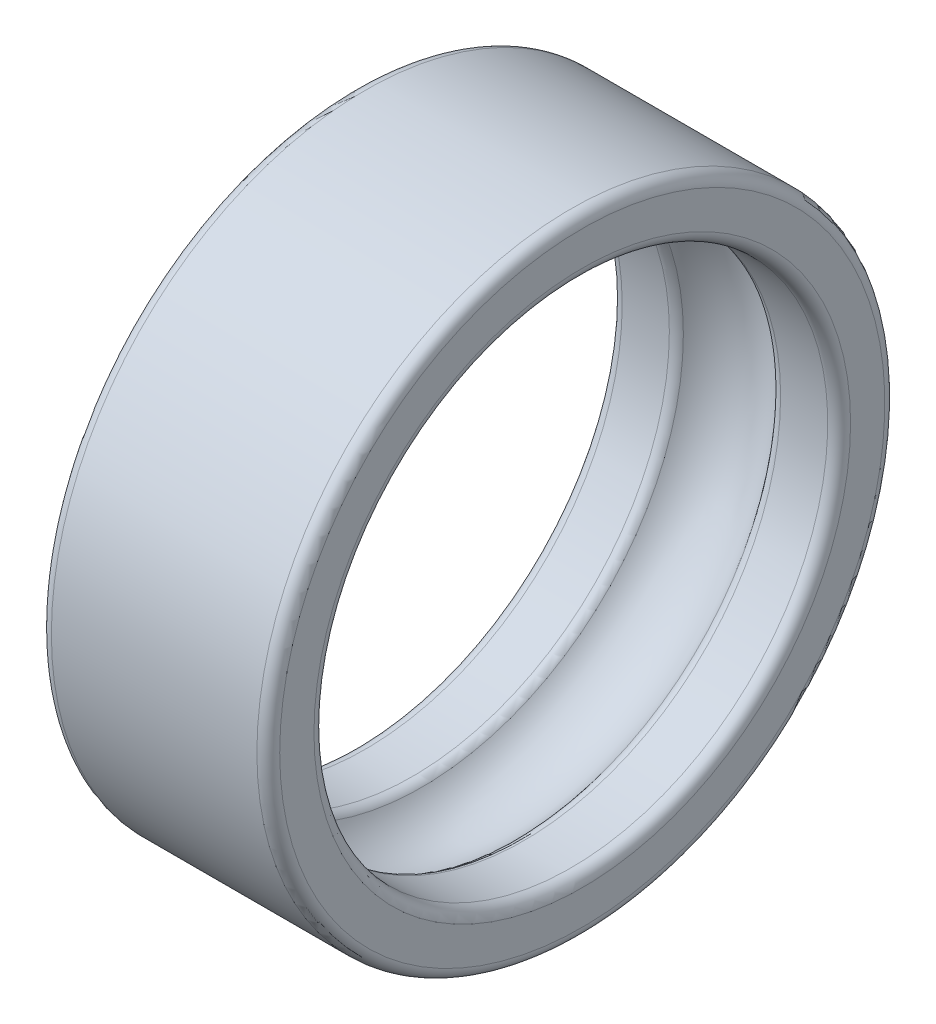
SolidWorks part; units mm, degrees
ref_plane "Plan1" through (0, 0, 0) normal (0, 0, 1) x (1, 0, 0)
ref_plane "Plan2" through (0, 0, 0) normal (0, 1, 0) x (1, 0, 0)
ref_plane "Plan3" through (0, 0, 0) normal (1, 0, 0) x (0, 0, -1)
sketch "Esquisse1" plane through (0, 0, 0) normal (0, 0, 1) x (1, 0, 0)
  line L0 (0, 0) -> (12.8822, 0) construction
  line L1 (0.866, 4.5) -> (2, 4.5)
  line L2 (-2, 5.5) -> (2, 5.5)
  line L3 (-2, 5.5) -> (-2, 4.5)
  line L4 (-2, 4.5) -> (-0.866, 4.5)
  line L5 (2, 5.5) -> (2, 4.5)
  arc A0 (0.866, 4.5) -> (-0.866, 4.5) centre (0, 4) ccw
  dimension "D5" = 2
  dimension "D1" = 2
  dimension "D2" = 4
  dimension "D3" = 5.5
  dimension "D4" = 1
  dimension "D6" = 4
  dimension "D7" = 2
revolve "Révolution1" add sketch "Esquisse1" angle 360 about L0
fillet "Congé1" radius 0.2
